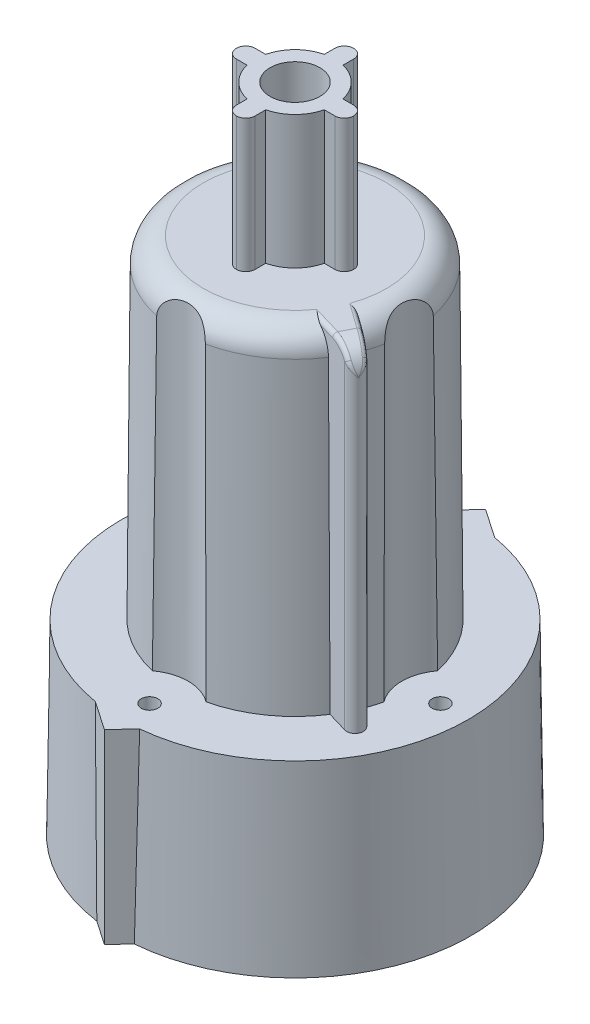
SolidWorks part; units mm, degrees
ref_plane "Plane1" through (0, 0, 0) normal (0, 0, 1) x (1, 0, 0)
ref_plane "Plane2" through (0, 0, 0) normal (0, 1, 0) x (1, 0, 0)
ref_plane "Plane3" through (0, 0, 0) normal (1, 0, 0) x (0, 0, -1)
sketch "revolve sketch" plane through (0, 0, 0) normal (0, 0, 1) x (1, 0, 0)
  line L0 (0, -41.8187) -> (0, 64.7099) construction
  line L1 (1.5, 46.3584) -> (2.5, 46.3584)
  line L2 (1.5, 14.8584) -> (5.5, 14.8584)
  line L3 (5.5, 14.8584) -> (5.5, 58.4584)
  line L4 (5.5, 58.4584) -> (12, 58.4584)
  line L5 (12, 58.4584) -> (12, -3.1416)
  line L6 (12, -3.1416) -> (14.5, -3.1416)
  line L7 (14.5, -3.1416) -> (14.5, -2.2416)
  line L8 (14.5, -2.2416) -> (21.15, -2.2416)
  line L9 (21.15, -2.2416) -> (20.85, 20.1584)
  line L10 (20.85, 20.1584) -> (14.3, 20.1584)
  line L11 (14.3, 20.1584) -> (14, 60.1584)
  line L12 (14, 60.1584) -> (4.785, 60.1584)
  line L13 (4.785, 60.1584) -> (4.785, 76.1584)
  line L14 (4.785, 76.1584) -> (3, 76.1584)
  line L15 (3, 76.1584) -> (3, 67.9584)
  line L16 (3, 67.9584) -> (1.5, 67.9584)
  line L17 (1.5, 67.9584) -> (1.5, 47.3584)
  line L19 (2.5, 47.3584) -> (1.5, 47.3584)
  line L20 (2.5, 47.3584) -> (2.5, 46.3584)
  line L21 (1.5, 46.3584) -> (1.5, 14.8584)
  dimension "D1" = 22.4
  dimension "D2" = 0.9
  dimension "D3" = 40
  dimension "D4" = 16
  dimension "D5" = 18
  dimension "D6" = 8.2
  dimension "D7" = 1.5
  dimension "D8" = 61.6
  dimension "D9" = 14
  dimension "D10" = 14.3
  dimension "D11" = 4.785
  dimension "D12" = 3
  dimension "D13" = 12
  dimension "D14" = 14.5
  dimension "D15" = 5.5
  dimension "D16" = 21.15
  dimension "D17" = 20.85
  dimension "D18" = 3.1416
  dimension "D19" = 31.5
  dimension "D20" = 1
  dimension "D21" = 1
revolve "basic revolved shape" add sketch "revolve sketch" angle 360 about L0
sketch "top rib sketch" plane through (0, 76.1584, 0) normal (0, 1, 0) x (-1, 0, 0)
  line L0 (9.0347, 0) -> (-10.9335, 0) construction
  line L1 (0, -10.9029) -> (0, 10.2904) construction
  line L2 (1.125, -4.6509) -> (-1.125, -4.6509)
  line L3 (1.125, -4.6509) -> (1.125, -7.0509)
  line L4 (-1.125, -7.0509) -> (1.125, -7.0509)
  line L6 (-1.125, -4.6509) -> (-1.125, -7.0509)
  circle A0 centre (0, 0) radius 4.785 construction
  point P7 (0, 7.0509)
  point P13 (0, -4.6509)
  point P15 (0, -7.0509)
  point P17 (0, 4.6509)
  dimension "D1" = 2.25
  dimension "D2" = 2.4
extrude "top ribs" add sketch "top rib sketch" along normal up to surface (16 mm away)
pattern_circular "copy of top ribs" count 4 every 90 about axis through (0, -41.8187, 0) along (0, 1, 0)
fillet "top rib fillet" radius 1.125
fillet "Fillet2" radius 3
sketch "side slot sketch" plane through (0, 60.1584, 0) normal (0, 1, 0) x (-1, 0, 0)
  circle A0 centre (-18.22, 0) radius 5.37
  dimension "D1" = 10.74
  dimension "D2" = 18.22
extrude "round side slots" cut sketch "side slot sketch" against normal up to surface (40 mm away)
pattern_circular "copy of round slots" count 4 every 90 about axis through (0, -41.8187, 0) along (0, 1, 0)
sketch "Sketch4" plane through (0, 20.1584, 0) normal (0, 1, 0) x (-1, 0, 0)
  line L0 (0, 24.9297) -> (0, -24.0109) construction
  line L1 (24.9603, 0) -> (-27.4717, 0) construction
  line L2 (0, -22.93) -> (-3.4672, -20.5597)
  line L3 (0, -22.93) -> (2.0589, -20.7481)
  line L4 (2.0589, -20.7481) -> (-3.4672, -20.5597)
  circle A0 centre (0, 0) radius 20.85 construction
  dimension "D1" = 4.2
  dimension "D2" = 3
  dimension "D3" = 22.93
extrude "triangular rib" add sketch "Sketch4" along normal up to surface (22.4 mm away)
pattern_circular "copy of triangular rib" count 2 every 180 about axis through (0, -41.8187, 0) along (0, 1, 0)
sketch "Sketch5" plane through (0, 14.8584, 0) normal (0, -1, 0) x (1, 0, 0)
  line L0 (-27.5433, 0) -> (24.1691, 0) construction
  line L1 (0, -25.196) -> (0, 0) construction
  line L2 (1.25, 5) -> (-1.25, 5)
  line L3 (-1.25, 5) -> (-1.25, 1.25)
  line L4 (-1.25, 1.25) -> (-5, 1.25)
  line L5 (0, 4.5844) -> (0, 26.1496) construction
  line L6 (1.25, 5) -> (1.25, 1.25)
  line L7 (1.25, 1.25) -> (5, 1.25)
  line L8 (5, 1.25) -> (5, -1.25)
  line L9 (-5, 1.25) -> (-5, -1.25)
  line L10 (1.25, -1.25) -> (5, -1.25)
  line L11 (1.25, -5) -> (1.25, -1.25)
  line L12 (1.25, -5) -> (-1.25, -5)
  line L13 (-1.25, -5) -> (-1.25, -1.25)
  line L14 (-1.25, -1.25) -> (-5, -1.25)
  point P12 (0, 5)
  point P19 (5, 0)
  point P24 (-5, 0)
  dimension "D1" = 2.5
  dimension "D2" = 2.5
  dimension "D3" = 10
  dimension "D4" = 10
extrude "bottom drive slots" cut sketch "Sketch5" against normal blind 8.3
sketch "Sketch6" plane through (0, 14.8584, 0) normal (0, -1, 0) x (1, 0, 0)
  circle A0 centre (0, 0) radius 2.1
  dimension "D1" = 4.2
extrude "center shaft hole" cut sketch "Sketch6" against normal offset from surface (52.1 mm away) 1
chamfer "short chamfer" distance 1 angle 45
sketch "Sketch8" plane through (0, 60.1584, 0) normal (0, 1, 0) x (-1, 0, 0)
  line L0 (0, 0) -> (-24.6886, 7.5792) construction
  line L1 (-8.6777, 6.7964) -> (-10.4369, 3.204)
  line L2 (-10.4369, 3.204) -> (-15.3635, 6.7457)
  line L3 (-14.4963, 8.5166) -> (-8.6777, 6.7964)
  circle A0 centre (0, 0) radius 11.0224 construction
  arc A1 (-15.3635, 6.7457) -> (-14.4963, 8.5166) centre (-14.7798, 7.5577) cw
  dimension "D3" = 1
  dimension "D1" = 1
  dimension "D2" = 4
  dimension "D4" = 17.6
  dimension "D5" = 10.9176
extrude "rib" add sketch "Sketch8" along normal up to surface (40 mm away)
fillet "Fillet5" radius 0.5
sketch "Sketch13" plane through (0, -2.2416, 0) normal (0, -1, 0) x (1, 0, 0)
  circle A0 centre (0, 0) radius 12
  circle A1 centre (0, 0) radius 9.2432
extrude "clean cut back of rib" cut sketch "Sketch13" against normal up to surface (60.7 mm away)
ref_plane "rib plane" through (0, 0, 0) normal (-0.4544, 0, 0.8908) x (0.8908, 0, 0.4544)
chamfer "long chamfer" distance 1 distance2 1.5
sketch "Sketch14" plane through (0, -2.2416, 0) normal (0, -1, 0) x (1, 0, 0)
  line L0 (-24.7598, 0) -> (24.8225, 0) construction
  line L1 (0, -26.0761) -> (0, 26.4522) construction
  circle A0 centre (17.5, 0) radius 1
  dimension "D1" = 2
  dimension "D2" = 17.5
extrude "rivet hole" cut sketch "Sketch14" against normal through all
pattern_circular "copies of rivet hole" count 4 every 90 about axis through (0, -41.8187, 0) along (0, 1, 0)
sketch "Sketch15" plane through (0, -2.2416, 0) normal (0, -1, 0) x (1, 0, 0)
  line L0 (0, 0) -> (-21.7395, 21.7395) construction
  line L1 (0, -28.9635) -> (0, 28.9635) construction
  line L2 (0, 0) -> (19.2473, -19.2473) construction
  line L3 (9.5475, -10.9617) -> (10.3042, -11.7184)
  line L4 (10.3042, -11.7184) -> (11.0113, -11.0113)
  line L5 (11.7184, -10.3042) -> (11.0113, -11.0113)
  line L6 (9.0817, -7.8436) -> (11.0113, -9.5971)
  line L7 (9.5475, -10.9617) -> (7.8436, -9.0817)
  line L8 (11.0113, -9.5971) -> (11.7184, -10.3042)
  circle A0 centre (0, 0) radius 12 construction
  arc A1 (7.8436, -9.0817) -> (9.0817, -7.8436) centre (0, 0) ccw
  dimension "D1" = 45
  dimension "D2" = 2
  dimension "D3" = 1
extrude "bottom blade tab" add sketch "Sketch15" along normal offset from surface (1.2 mm away) 0.3
pattern_circular "btm blade tab copy" count 2 every 180 about axis through (0, -41.8187, 0) along (0, 1, 0)
fillet "btm blade fillets" radius 1
sketch "Sketch16" plane through (0, -2.2416, 0) normal (0, -1, 0) x (1, 0, 0)
  circle A0 centre (17.5, 0) radius 4
  dimension "D1" = 8
extrude "bottom blade indent" cut sketch "Sketch16" against normal up to surface (0.9 mm away)
pattern_circular "copy indents" count 4 every 90 about axis through (0, -41.8187, 0) along (0, 1, 0)
sketch "Sketch17" plane through (0, 0, 0) normal (-0.4544, 0, 0.8908) x (0.8908, 0, 0.4544)
  line L0 (11.6, 60.1584) -> (17.6, 60.1584) construction
  line L1 (17.6, 54.1584) -> (17.6, 60.1584) construction
  line L2 (17.6, 20.1584) -> (17.6, 59.6584) construction
  line L3 (17.6, 60.1584) -> (14.6, 60.1584)
  line L4 (17.6, 60.1584) -> (17.6, 57.1584)
  line L6 (0, 61.4135) -> (0, 83.754) construction
  line L7 (0, -3.1416) -> (0, -3.4416) construction
  arc A0 (14.6, 60.1584) -> (17.6, 57.1584) centre (14.6, 57.1584) cw
  dimension "D1" = 3
revolve "rib cut" cut sketch "Sketch17" angle 360 about L6
fillet "rib cut fillet" radius 0.5
